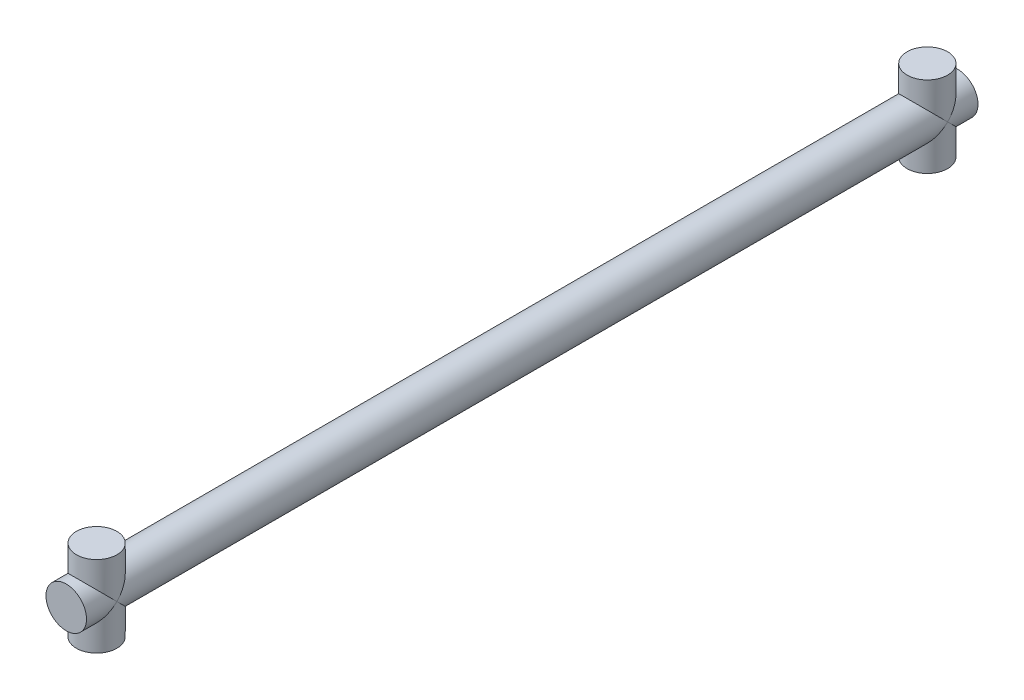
SolidWorks part; units mm, degrees
ref_plane "Plan de face" through (0, 0, 0) normal (0, 0, 1) x (1, 0, 0)
ref_plane "Plan de dessus" through (0, 0, 0) normal (0, 1, 0) x (1, 0, 0)
ref_plane "Plan de droite" through (0, 0, 0) normal (1, 0, 0) x (0, 0, -1)
sketch "Esquisse1" plane through (0, 0, 0) normal (0, 0, 1) x (1, 0, 0)
  circle A0 centre (0, 0) radius 2.5
  dimension "D1" = 5
extrude "Boss.-Extru.1" add sketch "Esquisse1" along normal mid plane 110
sketch "Esquisse2" plane through (0, 0, 0) normal (0, 1, 0) x (1, 0, 0)
  circle A0 centre (0, 51.25) radius 2.5
  circle A1 centre (0, -51.25) radius 2.5
  dimension "D1" = 5
  dimension "D2" = 5
  dimension "D3" = 102.5
  dimension "D4" = 51.25
extrude "Boss.-Extru.2" add sketch "Esquisse2" along normal mid plane 10
ref_plane "Plan1" through (0, 0, 0) normal (-1, 0, 0) x (0, 0, 1)
